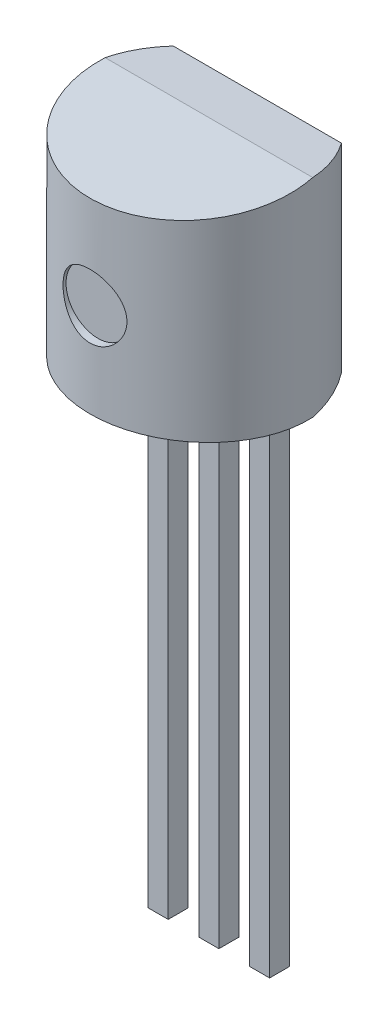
SolidWorks part; units mm, degrees
ref_plane "Front Plane" through (0, 0, 0) normal (0, 0, 1) x (1, 0, 0)
ref_plane "Top Plane" through (0, 0, 0) normal (0, 1, 0) x (1, 0, 0)
ref_plane "Right Plane" through (0, 0, 0) normal (1, 0, 0) x (0, 0, -1)
sketch "Sketch2" plane through (0, 0, 0) normal (0, 1, 0) x (1, 0, 0)
  line L0 (-2.6, 0) -> (2.6, 0) construction
  line L1 (-2.1054, 1.212) -> (2.1054, 1.212)
  line L2 (0, 0) -> (0, 1.212) construction
  arc A0 (-2.1054, 1.212) -> (2.1054, 1.212) centre (0, -0.354) ccw
  point P3 (0, 0)
  dimension "D1" = 4.19
  dimension "D2" = 5.2
  dimension "D3" = 2.27
extrude "Boss-Extrude1" add sketch "Sketch2" along normal mid plane 5.2
sketch "Sketch3" plane through (0, 2.6, 0) normal (0, 1, 0) x (1, 0, 0)
  line L0 (-2.6, 0) -> (2.6, 0) construction
  line L1 (-2.6, 0) -> (2.6, 0) construction
ref_plane "Plane1" through (0, 2.5803, -0.2257) normal (0, 0.9962, -0.0872) x (1, 0, 0)
ref_plane "Plane2" through (0, 2.5803, 0.2257) normal (0, 0.9962, 0.0872) x (1, 0, 0)
sketch "Sketch5" plane through (0, 2.5803, -0.2257) normal (0, 0.9962, -0.0872) x (1, 0, 0)
  line L1 (-4.9885, 2.0659) -> (6.8379, 2.0659)
  line L2 (-4.9885, 2.0659) -> (-4.9885, -3.5552)
  line L3 (-4.9885, -3.5552) -> (6.8379, -3.5552)
  line L4 (6.8379, 2.0659) -> (6.8379, -3.5552)
extrude "Cut-Extrude2" cut sketch "Sketch5" along normal through all
sketch "Sketch6" plane through (0, 2.5803, 0.2257) normal (0, 0.9962, 0.0872) x (1, 0, 0)
  line L1 (-5.588, 1.1618) -> (6.1027, 1.1618)
  line L2 (-5.588, 1.1618) -> (-5.588, -6.0928)
  line L3 (-5.588, -6.0928) -> (6.1027, -6.0928)
  line L4 (6.1027, 1.1618) -> (6.1027, -6.0928)
extrude "Cut-Extrude3" cut sketch "Sketch6" along normal blind 5.2
mirror "Mirror1" about plane through (0, 0, 0) normal (0, 1, 0) of "Cut-Extrude3", "Cut-Extrude2"
ref_plane "Plane3" through (0, -2.6, 0) normal (0, -1, 0) x (-1, 0, 0)
sketch "Sketch7" plane through (0, -2.6, 0) normal (0, -1, 0) x (-1, 0, 0)
  line L0 (-2.6, 0) -> (2.6, 0) construction
  line L1 (-1.52, 0) -> (-1.02, 0)
  line L2 (-1.52, 0) -> (-1.52, 0.5)
  line L3 (-1.52, 0.5) -> (-1.02, 0.5)
  line L4 (-1.02, 0) -> (-1.02, 0.5)
  line L5 (0, 0) -> (0, 0.5) construction
  line L6 (-0.25, 0) -> (0.25, 0)
  line L7 (-0.25, 0) -> (-0.25, 0.5)
  line L8 (-0.25, 0.5) -> (0.25, 0.5)
  line L9 (0.25, 0) -> (0.25, 0.5)
  line L10 (1.02, 0) -> (1.52, 0)
  line L11 (1.02, 0) -> (1.02, 0.5)
  line L12 (1.02, 0.5) -> (1.52, 0.5)
  line L13 (1.52, 0) -> (1.52, 0.5)
  line L14 (1.27, 0.5) -> (1.27, 0) construction
  line L15 (-1.27, 0.5) -> (-1.27, 0) construction
  dimension "D1" = 1.27
  dimension "D2" = 2.54
  dimension "D3" = 0.5
extrude "Boss-Extrude2" add sketch "Sketch7" along normal blind 12.7 and the other way up to body
ref_plane "Plane4" through (0, 0, 2.978) normal (0, 0, 1) x (1, 0, 0)
sketch "Sketch8" plane through (0, 0, 2.978) normal (0, 0, 1) x (1, 0, 0)
  circle A0 centre (0, 0) radius 0.8
  dimension "D1" = 1.6
extrude "Cut-Extrude4" cut sketch "Sketch8" against normal blind 0.2
sketch "Sketch9" plane through (0, 0, -1.212) normal (0, 0, -1) x (-1, 0, 0)
  line L0 (-1.3031, 0.1784) -> (1.2996, 0.1784) construction
  line L1 (-1.3031, -0.7444) -> (1.2996, -0.7444) construction
  text T0 "LM35" font "Arial" height in points 2
  text T1 "DZ" font "Arial" height in points 2
